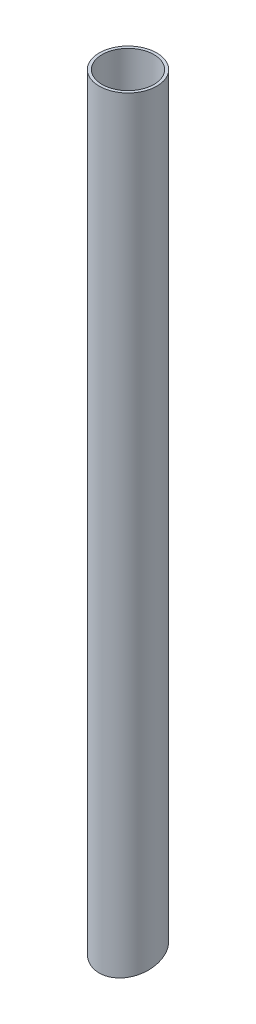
SolidWorks part; units mm, degrees
ref_plane "Vorne" through (0, 0, 0) normal (0, 0, 1) x (1, 0, 0)
ref_plane "Oben" through (0, 0, 0) normal (0, 1, 0) x (1, 0, 0)
ref_plane "Rechts" through (0, 0, 0) normal (1, 0, 0) x (0, 0, -1)
sketch "Skizze1" plane through (0, 0, 0) normal (0, 1, 0) x (1, 0, 0)
  circle A0 centre (0, 0) radius 15
  dimension "D1" = 30
extrude "Linear-Austragen-Dünn1" add sketch "Skizze1" along normal blind 400 thin
sketch "Skizze2" plane through (0, 0, 0) normal (1, 0, 0) x (0, 0, -1)
  line L0 (-15, 0) -> (15, 8.0385)
  line L3 (15, 0) -> (15, 400) construction
  line L4 (-15, 0) -> (15, 0) construction
  dimension "D1" = 15
extrude "Schnitt-Linear austragen1" cut sketch "Skizze2" against normal through all and the other way through all flip side to cut
sketch "Skizze3" plane through (0, -2.8722, 25.719) normal (0, 0.9659, 0.2588) x (1, 0, 0)
  line L0 (0, 42.1555) -> (0, 11.0972) construction
  ellipse E1 centre (0, 26.6263) end of major axis (0, 11.0972) minor radius 15 construction
sketch3d "3D-Skizze1"
  line L0 (-13.9799, 277.1471, -5.4372) -> (13.9799, 295.9821, 5.4372) construction
  line L1 (-360.877, 386.4917, 57.6929) -> (15, 268.0124, -10.7111) construction
  line L2 (-350.6164, 410.9056, 71.7883) -> (25.2606, 292.4263, 3.3843) construction
  line L4 (0, 286.5646, 0) -> (-3.5578, 287.7742, -14.572)
move or copy body "Körper-Verschieben/Kopieren1" [suppressed] bodies to move or copy 105
